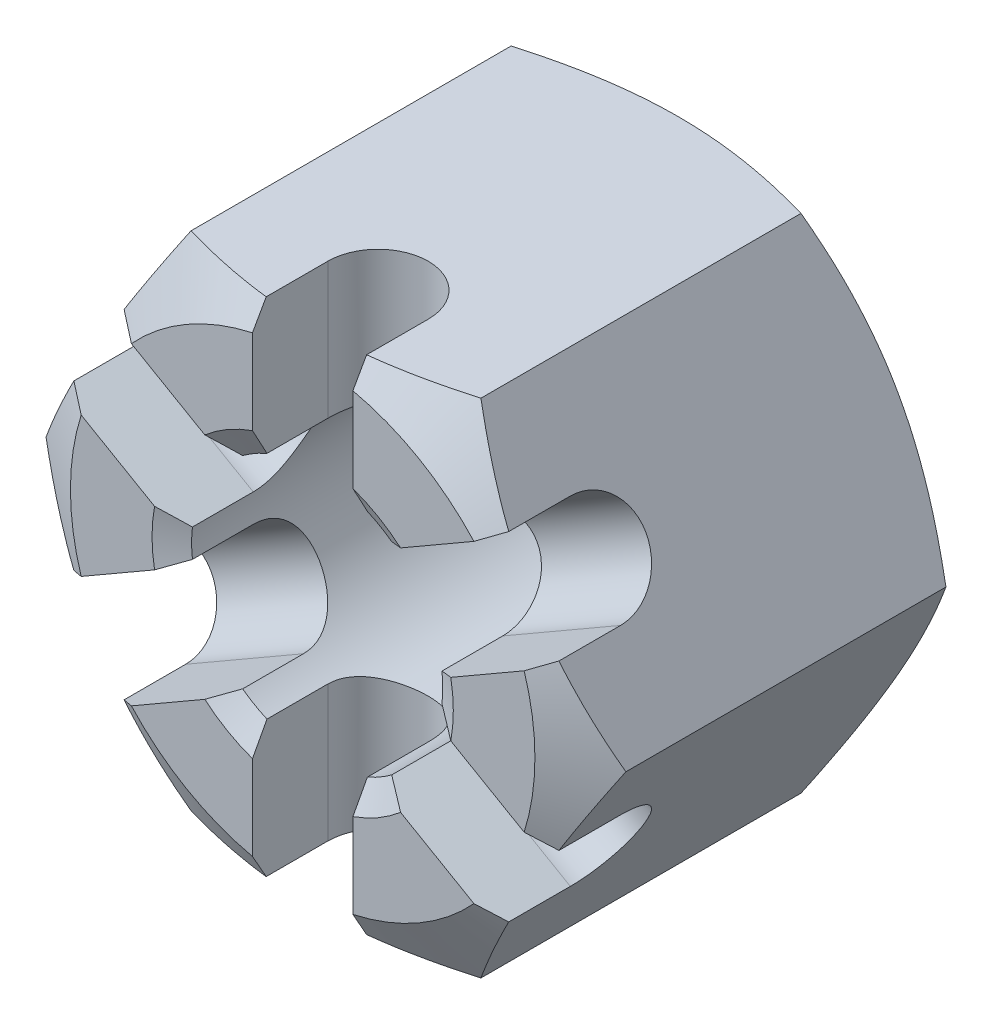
SolidWorks part; units mm, degrees
ref_plane "Front" through (0, 0, 0) normal (0, 0, 1) x (1, 0, 0)
ref_plane "Top" through (0, 0, 0) normal (0, 1, 0) x (1, 0, 0)
ref_plane "Right" through (0, 0, 0) normal (1, 0, 0) x (0, 0, -1)
sketch "Sketch1" plane through (0, 0, 0) normal (0, 0, 1) x (1, 0, 0)
  line L1 (2.8868, -5) -> (5.7735, 0)
  line L2 (5.7735, 0) -> (2.8868, 5)
  line L3 (2.8868, 5) -> (-2.8868, 5)
  line L4 (-2.8868, 5) -> (-5.7735, 0)
  line L5 (-5.7735, 0) -> (-2.8868, -5)
  line L6 (-2.8868, -5) -> (2.8868, -5)
  circle A0 centre (0, 0) radius 5 construction
  circle A1 centre (0, 0) radius 2.5
  dimension "D" = 5
  dimension "s" = 10
extrude "BaseNut" add sketch "Sketch1" against normal blind 7.7
sketch "Sketch2" plane through (0, 0, 0) normal (0, 1, 0) x (1, 0, 0)
  line L0 (-5.7735, 7.7) -> (-4.625, 7.7)
  line L2 (-4.625, 7.7) -> (-5.7735, 7.0369)
  line L3 (-5.7735, 7.0369) -> (-5.7735, 7.7)
  line L4 (0, 3.3759) -> (0, -9.8171) construction
  line L6 (-9.7712, 3.85) -> (9.8853, 3.85) construction
  line L7 (-5.7735, 0.6631) -> (-5.7735, 0)
  line L8 (-4.625, 0) -> (-5.7735, 0.6631)
  line L9 (-5.7735, 0) -> (-4.625, 0)
  dimension "D1" = 30
  dimension "dw" = 9.25
  dimension "D2" = 3.85
revolve "Double-Chamfer" cut sketch "Sketch2" angle 360 about L4
chamfer "EndChamfer" distance 0.5 angle 30 1 edges at (2.5, 0, 0)
sketch "Sketch3" plane through (0, 0, 0) normal (0, 1, 0) x (1, 0, 0)
  line L0 (0, 4.2201) -> (0, -10.5237) construction
  line L2 (-1, 0) -> (-1, 1.5)
  line L3 (1, 0) -> (1, 1.5)
  line L4 (2.7887, 7.7) -> (-2.7887, 7.7) construction
  arc A0 (-1, 1.5) -> (1, 1.5) centre (0, 1.5) cw
  point P2 (0, 2.5)
  point P3 (0, 7.7)
  dimension "D1" = 2.5
  dimension "W" = 5.2
  dimension "n" = 2
extrude "Slot" cut sketch "Sketch3" against normal through all and the other way through all
pattern_circular "SlotPattern" count 3 over 360 about axis through (0, 0, -3.3759) along (0, 0, 1) of "Slot"
sketch "Sketch4" plane through (0, 0, 0) normal (0, 1, 0) x (1, 0, 0)
  line L0 (4.625, 0) -> (4.625, 2.5)
  line L2 (4.625, 2.5) -> (5.7735, 3.1631)
  line L4 (4.625, 0) -> (5.7735, 0)
  line L5 (5.7735, 0) -> (5.7735, 3.1631)
  line L7 (0, -0.375) -> (0, -8.8366) construction
  line L19 (4.4106, 0) -> (4.625, 0) construction
  line L20 (5.7735, 7.0369) -> (5.7735, 0.6631) construction
  dimension "D1" = 30
  dimension "W" = 5.2
  dimension "de" = 9.25
revolve "Cut-Revolve1" [suppressed] cut sketch "Sketch4" angle 360 about L7
sketch "Sketch5" plane through (0, 0, 0) normal (0, 1, 0) x (1, 0, 0)
  line L0 (0, 8.5981) -> (0, -0.494) construction
  line L1 (-2.5, 7.95) -> (-2.933, 7.7)
  line L2 (-2.933, 7.7) -> (-2.5, 7.45)
  line L3 (-2.5, 7.45) -> (-2, 7.45)
  line L4 (-2, 7.45) -> (-2, 7.95)
  line L5 (-2, 7.95) -> (-2.5, 7.95)
  dimension "D1" = 0.5
  dimension "D2" = 5
revolve "Cut-Revolve10" [suppressed] cut sketch "Sketch5" angle 360 about L0
pattern_linear "LPattern10" [suppressed] count 13 spacing 0.6 along (0, 0, 1)
equation "\"dw@Sketch2\" = \"s@Sketch1\"-0.75"
equation "\"de@Sketch4\" = \"dw@Sketch2\""
equation "\"D1@Sketch3\" = \"m@BaseNut\" - \"W@Sketch3\""
equation "\"D2@Sketch2\" = \"m@BaseNut\" / 2"
equation "\"W@Sketch4\" = \"W@Sketch3\""
equation "\"D2@Sketch5\"=\"D@Sketch1\""
equation "\"D1@Sketch5\"= ( \"D@ThreadCosmetic1\"-\"D2@Sketch5\" )  / 2"
equation "\"D3@LPattern10\" = \"D1@Sketch5\" * 1.2"
equation "\"D1@LPattern10\" = \"m@BaseNut\" / \"D3@LPattern10\""
equation "\"D1@EndChamfer\"=\"D@Sketch1\" / 10"
